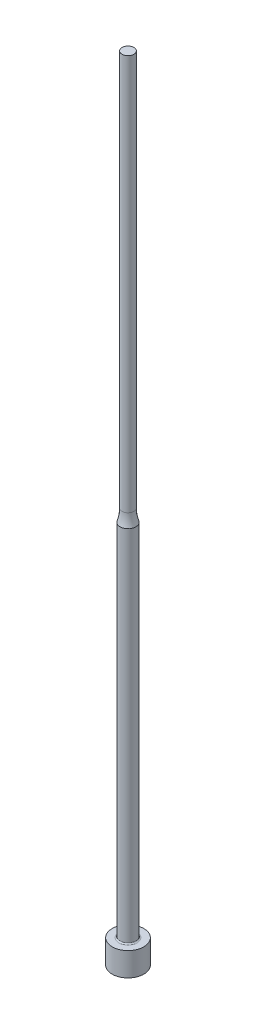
SolidWorks part; units mm, degrees
ref_plane "Front Plane" through (0, 0, 0) normal (0, 0, 1) x (1, 0, 0)
ref_plane "Top Plane" through (0, 0, 0) normal (0, 1, 0) x (1, 0, 0)
ref_plane "Right Plane" through (0, 0, 0) normal (1, 0, 0) x (0, 0, -1)
sketch "Sketch1" plane through (0, 0, 0) normal (0, 0, 1) x (1, 0, 0)
  line L0 (0, 0) -> (4, 0)
  line L1 (55, 0) -> (-55, 0) construction
  line L2 (4, 0) -> (4, 6)
  line L3 (4, 6) -> (2.3, 6)
  line L4 (2, 6.3) -> (2, 96.8775)
  line L6 (1.5, 100) -> (1.5, 200)
  line L7 (1.5, 200) -> (0, 200)
  line L8 (0, 200) -> (0, 0)
  arc A0 (1.5, 100) -> (2, 96.8775) centre (11.5, 100) ccw
  arc A1 (2.3, 6) -> (2, 6.3) centre (2.3, 6.3) cw
  dimension "D7" = 100
  dimension "D8" = 0.3
  dimension "D5" = 10
  dimension "D1" = 1.5
  dimension "D2" = 2
  dimension "D3" = 4
  dimension "D4" = 6
  dimension "D6" = 200
revolve "Revolve1" add sketch "Sketch1" angle 360 about L8
